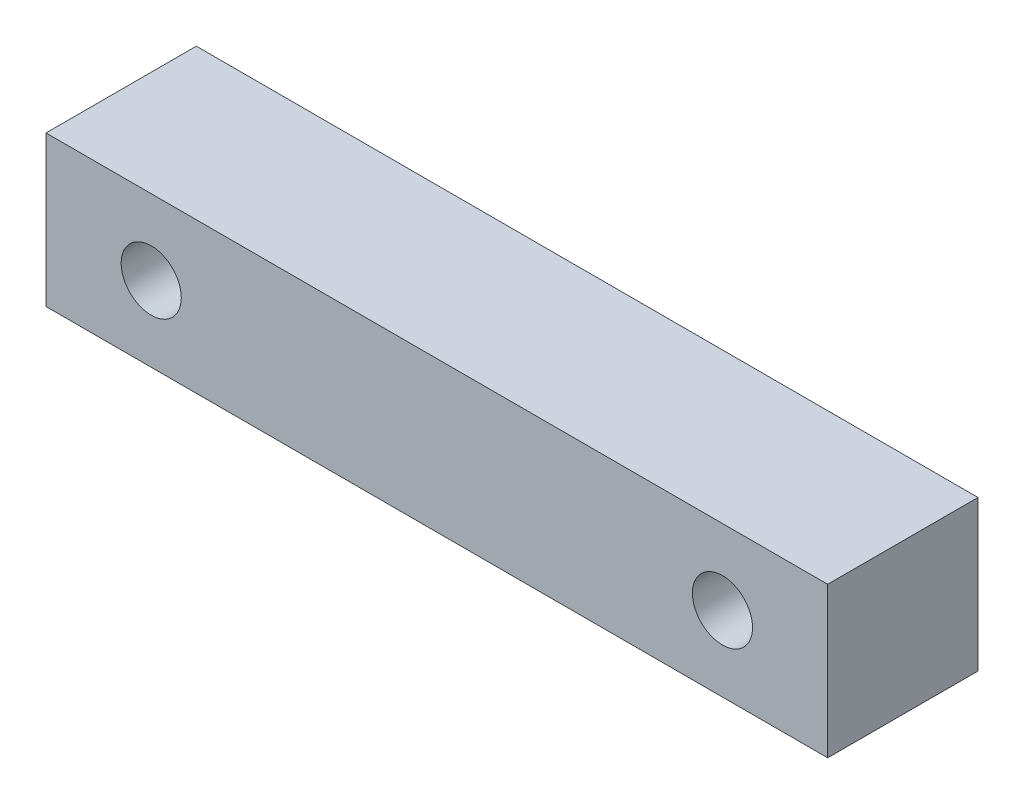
SolidWorks part; units mm, degrees
ref_plane "Front Plane" through (0, 0, 0) normal (0, 0, 1) x (1, 0, 0)
ref_plane "Top Plane" through (0, 0, 0) normal (0, 1, 0) x (1, 0, 0)
ref_plane "Right Plane" through (0, 0, 0) normal (1, 0, 0) x (0, 0, -1)
sketch "Sketch1" plane through (0, 0, 0) normal (0, 0, 1) x (1, 0, 0)
  line L1 (-13, 2.5) -> (13, 2.5)
  line L2 (-13, 2.5) -> (-13, -2.5)
  line L3 (-13, -2.5) -> (13, -2.5)
  line L4 (13, 2.5) -> (13, -2.5)
extrude "Boss-Extrude1" add sketch "Sketch1" along normal blind 5
sketch "Sketch2" plane through (0, 0, 5) normal (0, 0, 1) x (1, 0, 0)
  line L0 (-13, 2.5) -> (-13, -2.5) construction
  line L1 (13, -2.5) -> (13, 2.5) construction
  circle A0 centre (-9.5, 0) radius 1
  circle A1 centre (9.5, 0) radius 1
  dimension "D1" = 3.5
  dimension "D2" = 3.5
extrude "Cut-Extrude1" cut sketch "Sketch2" against normal blind 5
